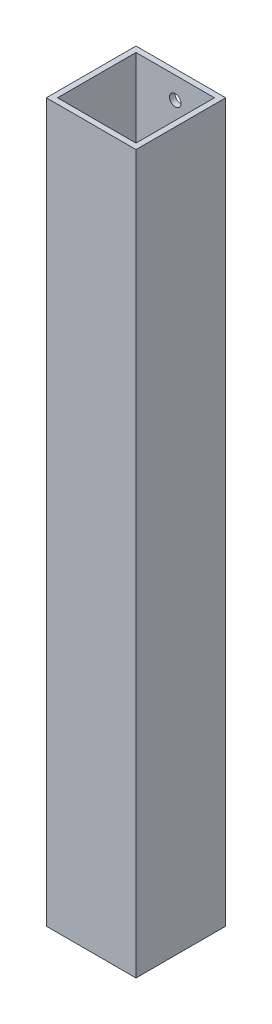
SolidWorks part; units mm, degrees
ref_plane "Front Plane" through (0, 0, 0) normal (0, 0, 1) x (1, 0, 0)
ref_plane "Top Plane" through (0, 0, 0) normal (0, 1, 0) x (1, 0, 0)
ref_plane "Right Plane" through (0, 0, 0) normal (1, 0, 0) x (0, 0, -1)
sketch "Sketch1" plane through (0, 0, 0) normal (0, 1, 0) x (1, 0, 0)
  line L1 (-12.7, -12.7) -> (12.7, -12.7)
  line L2 (-12.7, -12.7) -> (-12.7, 12.7)
  line L3 (-12.7, 12.7) -> (12.7, 12.7)
  line L4 (12.7, -12.7) -> (12.7, 12.7)
  line L5 (-12.7, -12.7) -> (12.7, 12.7) construction
  line L6 (-12.7, 12.7) -> (12.7, -12.7) construction
  line L7 (-11.1125, -11.1125) -> (11.1125, -11.1125)
  line L8 (-11.1125, -11.1125) -> (-11.1125, 11.1125)
  line L9 (-11.1125, 11.1125) -> (11.1125, 11.1125)
  line L10 (11.1125, -11.1125) -> (11.1125, 11.1125)
  line L11 (-11.1125, -11.1125) -> (11.1125, 11.1125) construction
  line L12 (-11.1125, 11.1125) -> (11.1125, -11.1125) construction
  point P0 (0, 0)
  point P5 (0, 0)
  dimension "D1" = 25.4
  dimension "D2" = 1.5875
extrude "Boss-Extrude1" add sketch "Sketch1" along normal blind 203.2
sketch "Sketch2" plane through (0, 0, -12.7) normal (0, 0, -1) x (-1, 0, 0)
  circle A9 centre (0, 146.2477) radius 1.6319 construction
  circle A10 centre (0, 171.6477) radius 1.6319 construction
  circle A11 centre (0, 197.0477) radius 1.6319 construction
  circle A12 centre (0, 146.2477) radius 1.6319
  circle A13 centre (0, 171.6477) radius 1.6319
  circle A14 centre (0, 197.0477) radius 1.6319
extrude "Cut-Extrude1" cut sketch "Sketch2" against normal up to surface (1.5875 mm away)
